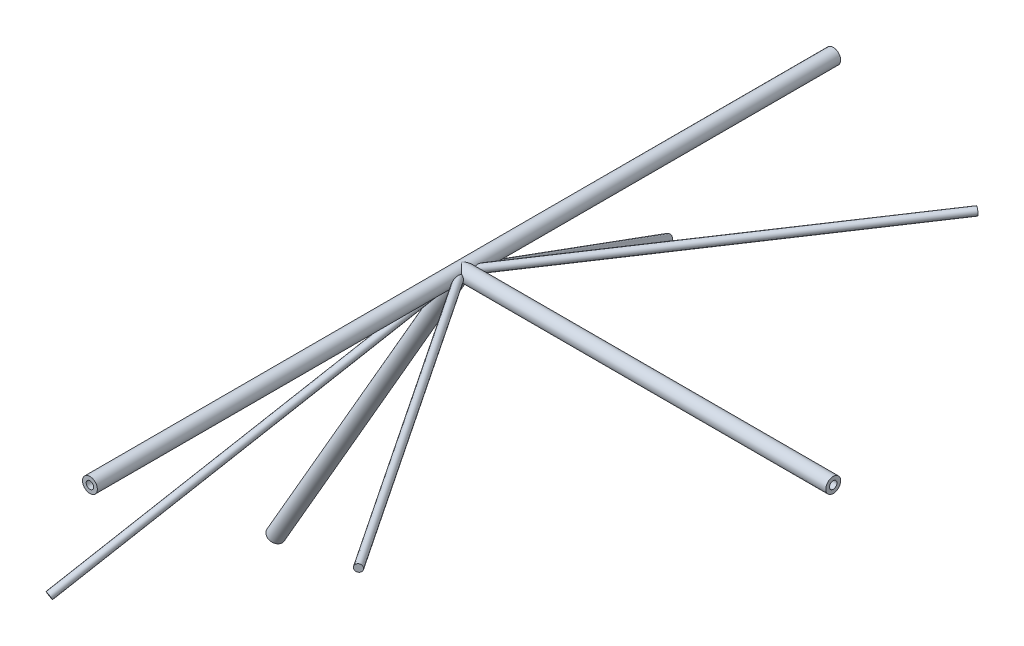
SolidWorks part; units mm, degrees
ref_plane "Front Plane" through (0, 0, 0) normal (0, 0, 1) x (1, 0, 0)
ref_plane "Top Plane" through (0, 0, 0) normal (0, 1, 0) x (1, 0, 0)
ref_plane "Right Plane" through (0, 0, 0) normal (1, 0, 0) x (0, 0, -1)
sketch "Sketch3" plane through (0, 0, 0) normal (0, 1, 0) x (1, 0, 0)
  line L0 (0, 0) -> (500, 0)
  dimension "D1" = 500
sketch "Sketch5" plane through (0, 0, 0) normal (0, 0, 1) x (1, 0, 0)
  line L0 (0, 0) -> (-250, -433.0127)
  line L1 (0, 0) -> (500, 0) construction
  dimension "D1" = 120
  dimension "D2" = 500
sketch "Sketch6" plane through (0, 0, 0) normal (1, 0, 0) x (0, 0, -1)
  line L0 (500, 0) -> (-500, 0)
  dimension "D1" = 1000
ref_plane "Plane1" through (0, 0, 500) normal (0, 0, 1) x (1, 0, 0)
ref_plane "Plane2" through (500, 0, 0) normal (1, 0, 0) x (0, 0, -1)
ref_plane "Plane3" through (0, 0, 0) normal (0.866, -0.5, 0) x (0, 0, -1)
ref_plane "Plane4" through (-250, -433.0127, 0) normal (-0.5, -0.866, 0) x (-0.866, 0.5, 0)
sketch "Sketch7" plane through (0, 0, 500) normal (0, 0, 1) x (1, 0, 0)
  circle A0 centre (0, 0) radius 10
  dimension "D1" = 20
sketch "Sketch8" plane through (500, 0, 0) normal (1, 0, 0) x (0, 0, -1)
  circle A0 centre (0, 0) radius 10
  dimension "D1" = 20
sketch "Sketch9" plane through (-250, -433.0127, 0) normal (-0.5, -0.866, 0) x (-0.866, 0.5, 0)
  circle A0 centre (0, 0) radius 10
  dimension "D1" = 20
sweep "Sweep1" add profiles "Sketch7" path "Sketch6"
sweep "Sweep2" add profiles "Sketch9" path "Sketch5"
sweep "Sweep3" add profiles "Sketch8" path "Sketch3"
sketch "Sketch10" plane through (0, 0, 0) normal (0, 1, 0) x (1, 0, 0)
  line L1 (0, 0) -> (277.3496, -416.0255)
  line L3 (0, 0) -> (0, -20.4267) construction
  dimension "D2" = 33.69
  dimension "D4" = 500
sketch "Sketch11" plane through (0, 0, 0) normal (0.866, -0.5, 0) x (0, 0, -1)
  line L1 (0, 0) -> (65.3175, 0) construction
  line L3 (0, 0) -> (-416.0255, -277.3496)
  dimension "D1" = 33.69
  dimension "D3" = 500
sketch "Sketch16" plane through (0, 0, 0) normal (0, 1, 0) x (1, 0, 0)
  line L0 (0, 0) -> (277.3496, 416.0255)
  line L1 (0, 0) -> (26.8077, 0) construction
  line L3 (0, 200000) -> (0, -200020.4267) construction
  dimension "D1" = 33.69
  dimension "D2" = 500
sketch "Sketch17" plane through (0, 0, 0) normal (0.866, -0.5, 0) x (0, 0, -1)
  line L0 (0, 0) -> (416.0255, -277.3496)
  line L1 (0, 0) -> (-65.4122, 0) construction
  dimension "D1" = 33.69
  dimension "D2" = 500
ref_plane "Plane5" through (277.3496, 0, -416.0255) normal (0.5547, 0, -0.8321) x (-0.8321, 0, -0.5547)
ref_plane "Plane6" through (277.3496, 0, 416.0255) normal (0.5547, 0, 0.8321) x (0.8321, 0, -0.5547)
ref_plane "Plane7" through (-138.6748, -240.1918, -416.0255) normal (-0.2773, -0.4804, -0.8321) x (-0.959, 0.1906, 0.2097)
ref_plane "Plane8" through (-138.6748, -240.1918, 416.0255) normal (-0.2773, -0.4804, 0.8321) x (0.959, -0.1906, 0.2097)
sketch "Sketch12" plane through (277.3496, 0, -416.0255) normal (0.5547, 0, -0.8321) x (-0.8321, 0, -0.5547)
  circle A0 centre (0, 0) radius 5
  dimension "D1" = 10
sketch "Sketch13" plane through (277.3496, 0, 416.0255) normal (0.5547, 0, 0.8321) x (0.8321, 0, -0.5547)
  circle A0 centre (0, 0) radius 5
  dimension "D1" = 10
sketch "Sketch14" plane through (-138.6748, -240.1918, -416.0255) normal (-0.2773, -0.4804, -0.8321) x (-0.959, 0.1906, 0.2097)
  circle A0 centre (0, 0) radius 5
  dimension "D1" = 10
sketch "Sketch15" plane through (-138.6748, -240.1918, 416.0255) normal (-0.2773, -0.4804, 0.8321) x (0.959, -0.1906, 0.2097)
  circle A0 centre (0, 0) radius 5
  dimension "D1" = 10
sweep "Sweep4" add profiles "Sketch13" path "Sketch10"
sweep "Sweep5" add profiles "Sketch12" path "Sketch16"
sweep "Sweep6" add profiles "Sketch14" path "Sketch17"
sweep "Sweep7" add profiles "Sketch15" path "Sketch11"
shell "Shell1" thickness 5
